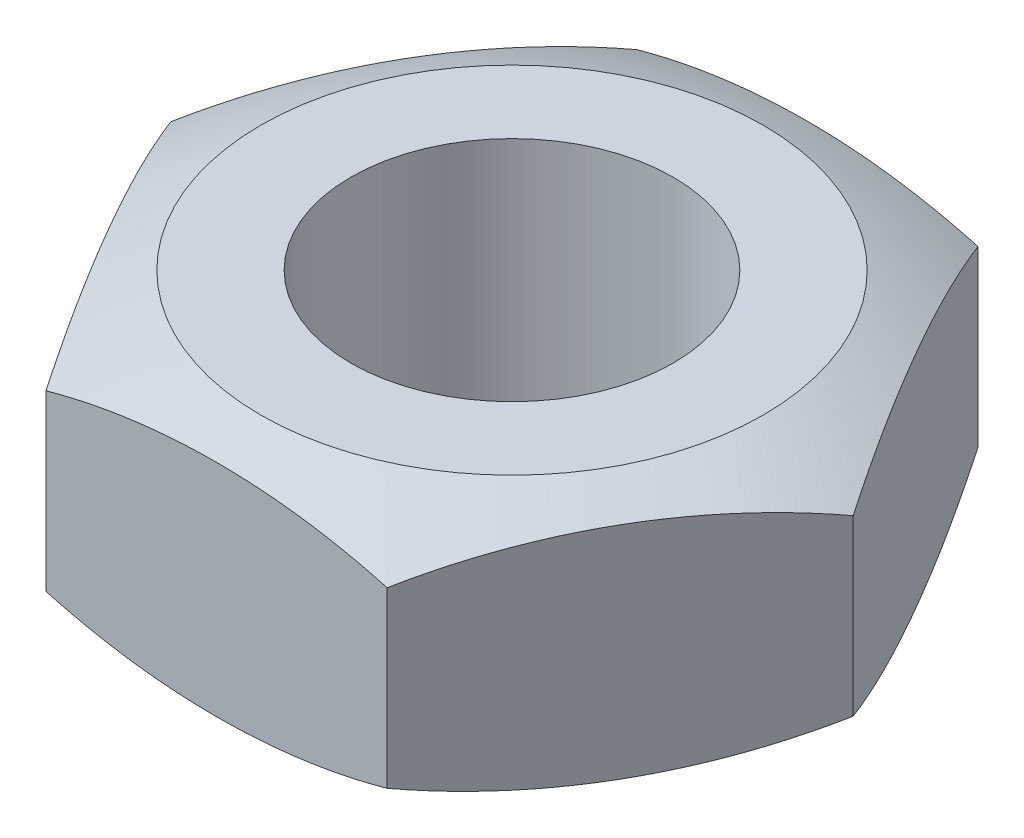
SolidWorks part; units mm, degrees
ref_plane "Front" through (0, 0, 0) normal (0, 0, 1) x (1, 0, 0)
ref_plane "Top" through (0, 0, 0) normal (0, 1, 0) x (1, 0, 0)
ref_plane "Right" through (0, 0, 0) normal (1, 0, 0) x (0, 0, -1)
sketch "profile" plane through (0, 0, 0) normal (0, 1, 0) x (1, 0, 0)
  line L1 (3.1754, 0) -> (1.5877, 2.75)
  line L2 (1.5877, 2.75) -> (-1.5877, 2.75)
  line L3 (-1.5877, 2.75) -> (-3.1754, 0)
  line L4 (-3.1754, 0) -> (-1.5877, -2.75)
  line L5 (-1.5877, -2.75) -> (1.5877, -2.75)
  line L6 (1.5877, -2.75) -> (3.1754, 0)
  circle A0 centre (0, 0) radius 2.75 construction
  dimension "width" = 5.5
extrude "body" add sketch "profile" along normal blind 2.4
sketch "thread"
  circle A0 centre (0, 0) radius 1.5
  dimension "diameter" = 3
revolve "fillet" cut sketch "fillet_sketch" angle 360 about L2
sketch "fillet_sketch" plane through (0, 0, 0) normal (0, 0, 1) x (1, 0, 0)
  line L1 (3.1754, 0) -> (1.5, 0) construction
  line L2 (0, -0.4327) -> (0, 2.8327) construction
  line L3 (3.1754, 2.4) -> (3.1754, 0) construction
  line L4 (1.5877, 0) -> (3.1754, 0) construction
  line L6 (0, 1.2) -> (3.1754, 1.2) construction
  line L7 (-1.5877, 0) -> (1.5877, 0) construction
  line L8 (-1.5877, 2.4) -> (1.5877, 2.4) construction
  line L9 (3.1754, 2.0088) -> (3.1754, 0.3912)
  line L10 (0, 2.8327) -> (0, 6.0982)
  line L11 (0, 6.0982) -> (6.4409, 6.0982)
  line L12 (6.4409, 6.0982) -> (6.4409, -3.6982)
  line L13 (6.4409, -3.6982) -> (0, -3.6982)
  line L14 (0, -3.6982) -> (0, -0.4327)
  line L15 (3.1754, 1.2) -> (6.4409, 1.2) construction
  arc A0 (0, -0.4327) -> (3.1754, 0.3912) centre (0, 6.0982) ccw
  arc A1 (0, 2.8327) -> (3.1754, 2.0088) centre (0, -3.6982) cw
  point P12 (2.3377, 0)
extrude "hole" cut sketch "thread" against normal through all
